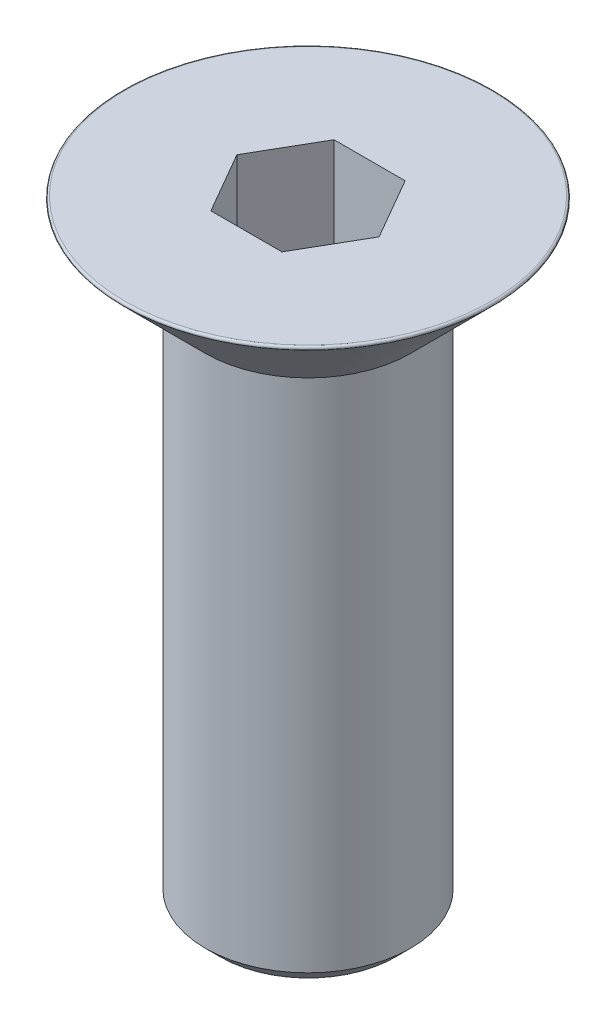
SolidWorks part; units mm, degrees
ref_plane "Plan1" through (0, 0, 0) normal (0, 0, 1) x (1, 0, 0)
ref_plane "Plan2" through (0, 0, 0) normal (0, 1, 0) x (1, 0, 0)
ref_plane "Plan3" through (0, 0, 0) normal (1, 0, 0) x (0, 0, -1)
sketch "Esquisse1" plane through (0, 0, 0) normal (0, 0, 1) x (1, 0, 0)
  line L0 (0, 18.0203) -> (0, -28.5165) construction
  line L1 (0, 0) -> (9.15, 0)
  line L2 (9.15, 0) -> (5, -4.15)
  line L3 (5, -4.15) -> (5, -30)
  line L4 (5, -30) -> (0, -30)
  line L5 (0, -30) -> (0, 0)
  dimension "D1" = 45
  dimension "D2" = 10
  dimension "D3" = 18.3
  dimension "D4" = 30
revolve "Base-Révolution" add sketch "Esquisse1" angle 360 about L0
sketch "Esquisse2" plane through (-0.4184, 0, 2.0942) normal (0, 1, 0) x (-1, 0, 0)
  line L0 (-0.4184, 2.3614) -> (-0.4184, -7.5614) construction
  line L1 (-5.5714, -2.0942) -> (5.0206, -2.0942) construction
  line L2 (1.3136, 0.9058) -> (3.0457, -2.0942)
  line L3 (1.3136, 0.9058) -> (-2.1505, 0.9058)
  line L4 (-2.1505, 0.9058) -> (-3.8825, -2.0942)
  line L5 (1.3136, -5.0942) -> (3.0457, -2.0942)
  line L6 (-2.1505, -5.0942) -> (-3.8825, -2.0942)
  line L7 (1.3136, -5.0942) -> (-2.1505, -5.0942)
  circle A0 centre (-0.4184, -2.0942) radius 3.4641 construction
  point P13 (-0.4184, 0.9058)
  dimension "D1" = 6
extrude "Enlèv. mat.-Extru.1" cut sketch "Esquisse2" against normal blind 5
chamfer "Chanfrein1" distance 0.75 angle 45
fillet "Congé1" radius 0.1
